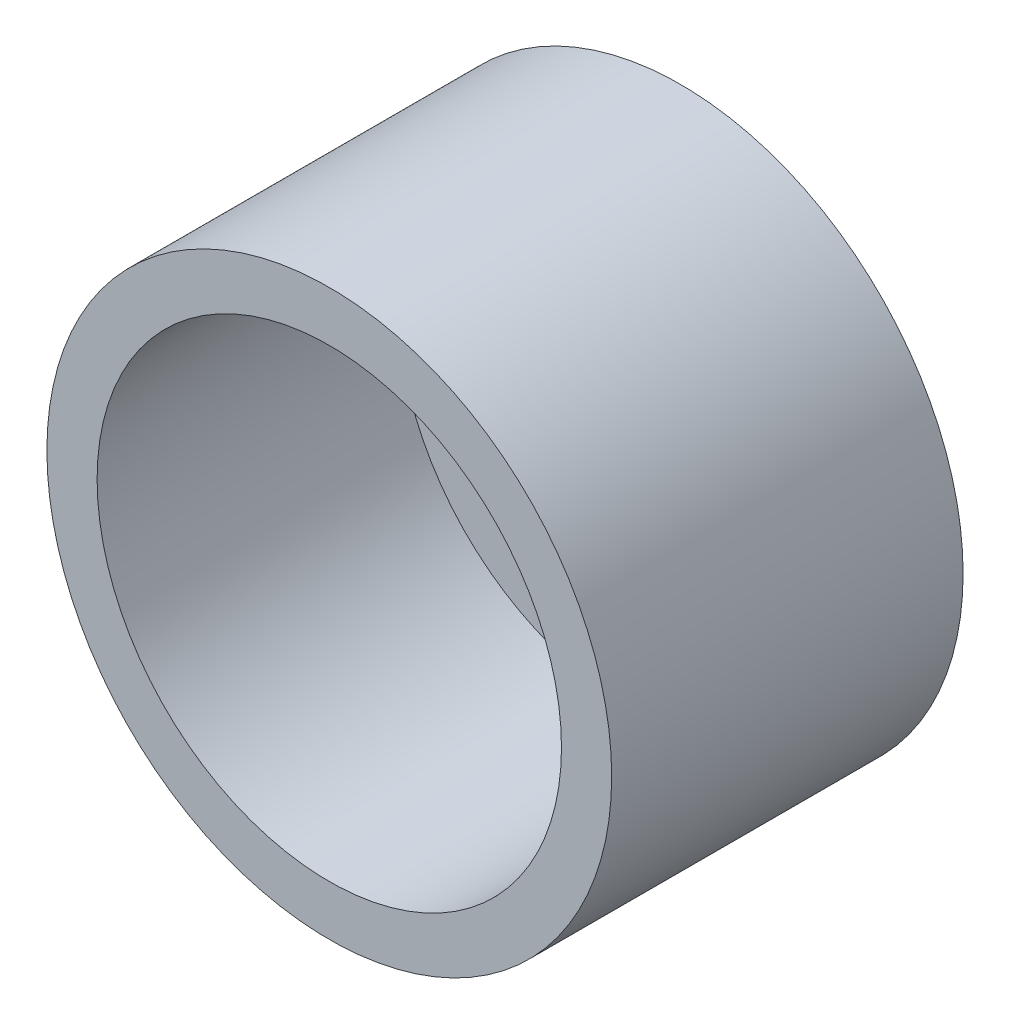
SolidWorks part; units mm, degrees
ref_plane "Front Plane" through (0, 0, 0) normal (0, 0, 1) x (1, 0, 0)
ref_plane "Top Plane" through (0, 0, 0) normal (0, 1, 0) x (1, 0, 0)
ref_plane "Right Plane" through (0, 0, 0) normal (1, 0, 0) x (0, 0, -1)
sketch "Sketch1" plane through (0, 0, 0) normal (0, 0, 1) x (1, 0, 0)
  circle A0 centre (0, 0) radius 14.2875
  dimension "D1" = 28.575
extrude "Boss-Extrude1" add sketch "Sketch1" along normal blind 17.78
shell "Shell1" thickness 2.54
